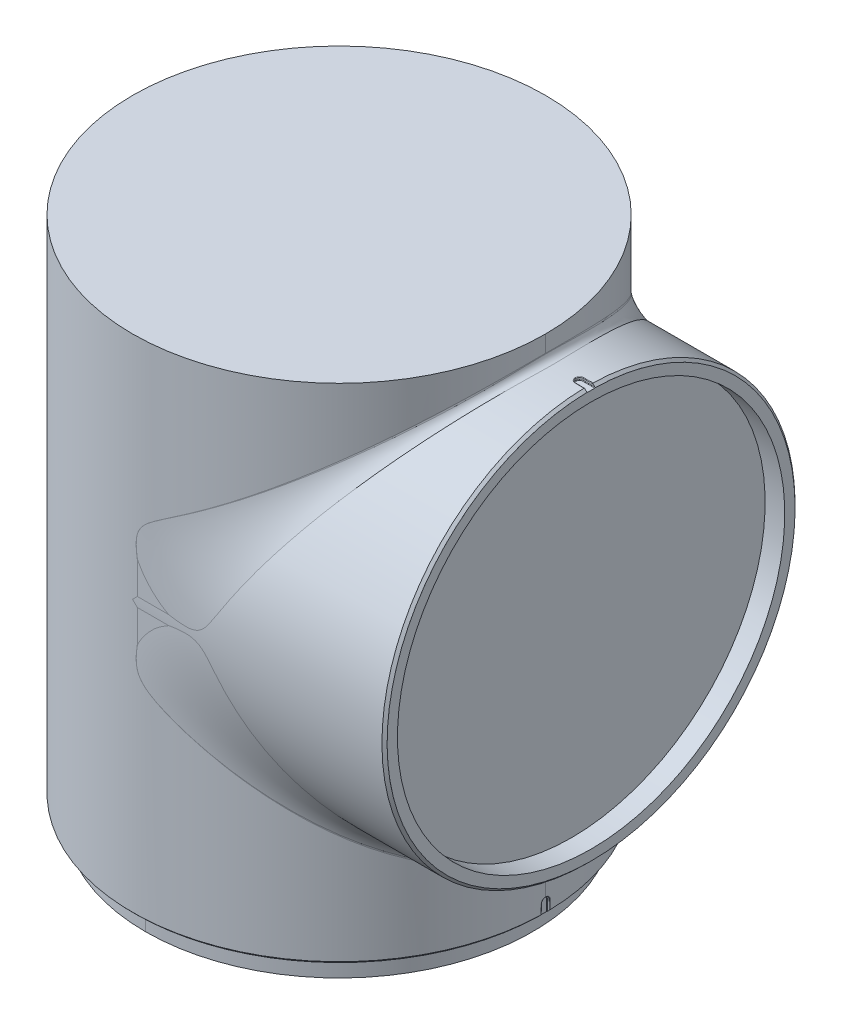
SolidWorks part; units mm, degrees
ref_plane "前视基准面" through (0, 0, 0) normal (0, 0, 1) x (1, 0, 0)
ref_plane "上视基准面" through (0, 0, 0) normal (0, 1, 0) x (1, 0, 0)
ref_plane "右视基准面" through (0, 0, 0) normal (1, 0, 0) x (0, 0, -1)
imported_body "14关节1.STEP"
sketch "草图2" plane through (45, 0, 0) normal (1, 0, 0) x (0, 0, -1)
  circle A0 centre (0, 40.2) radius 37.5
extrude "凸台-拉伸1" add sketch "草图2" against normal blind 40
sketch "草图3" plane through (0, 0, 0) normal (0, 0, 1) x (1, 0, 0)
  line L0 (0, 86.2) -> (-39.5, 86.2) construction
  line L1 (-83.3432, 131.8172) -> (87.8733, 131.8172)
  line L2 (-83.3432, 131.8172) -> (-83.3432, 86.2)
  line L3 (-83.3432, 86.2) -> (87.8733, 86.2)
  line L4 (87.8733, 131.8172) -> (87.8733, 86.2)
extrude "切除-拉伸1" cut sketch "草图3" against normal mid plane 196
sketch "草图4" plane through (0, 86.2, 0) normal (0, 1, 0) x (1, 0, 0)
  circle A0 centre (0, 0) radius 80.7003
extrude "切除-拉伸2" cut sketch "草图4" against normal blind 1.5
other "删除面1"
